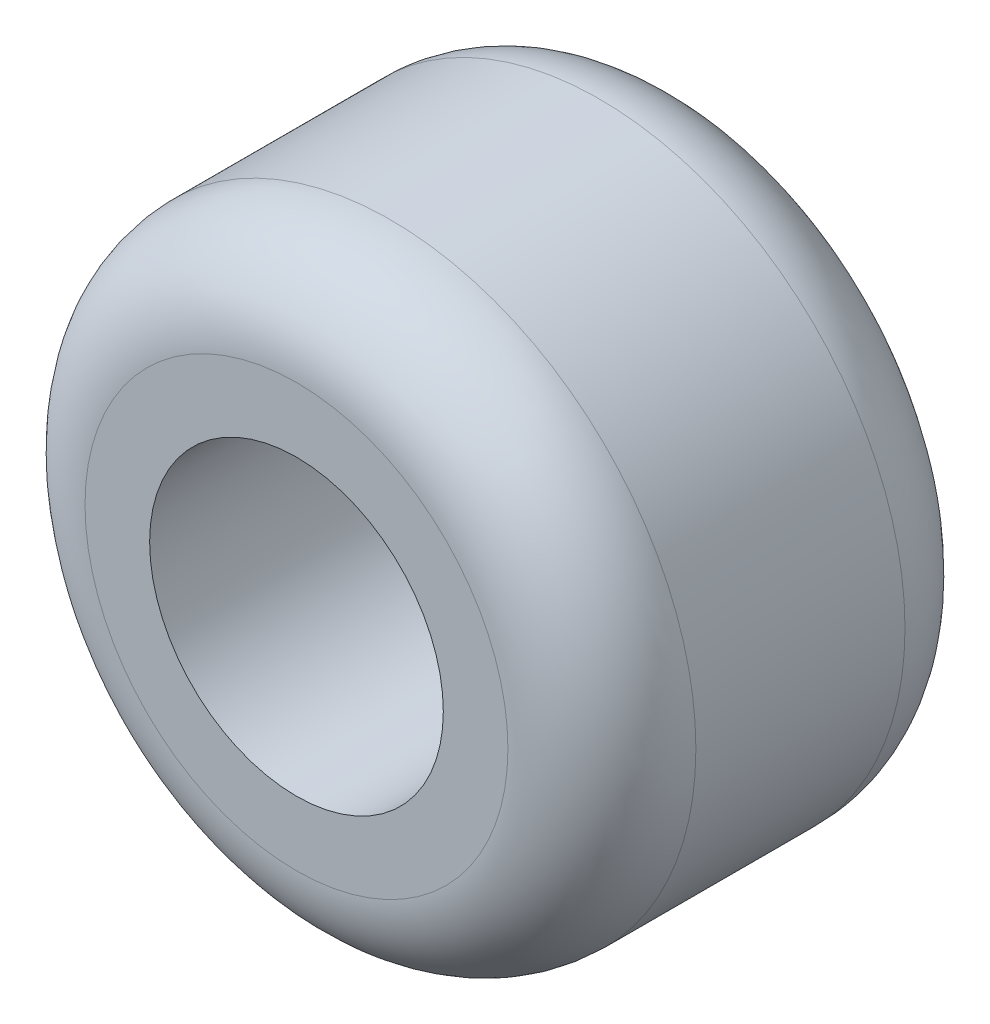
SolidWorks part; units mm, degrees
ref_plane "Plan1" through (0, 0, 0) normal (0, 0, 1) x (1, 0, 0)
ref_plane "Plan2" through (0, 0, 0) normal (0, 1, 0) x (1, 0, 0)
ref_plane "Plan3" through (0, 0, 0) normal (1, 0, 0) x (0, 0, -1)
sketch "Esquisse1" plane through (0, 0, 0) normal (0, 0, 1) x (1, 0, 0)
  circle A0 centre (0, 0) radius 62.5
  circle A1 centre (0, 0) radius 130
  dimension "D1" = 125
  dimension "D2" = 260
extrude "Base-Extrusion" add sketch "Esquisse1" along normal blind 169
fillet "Congé1" radius 40
